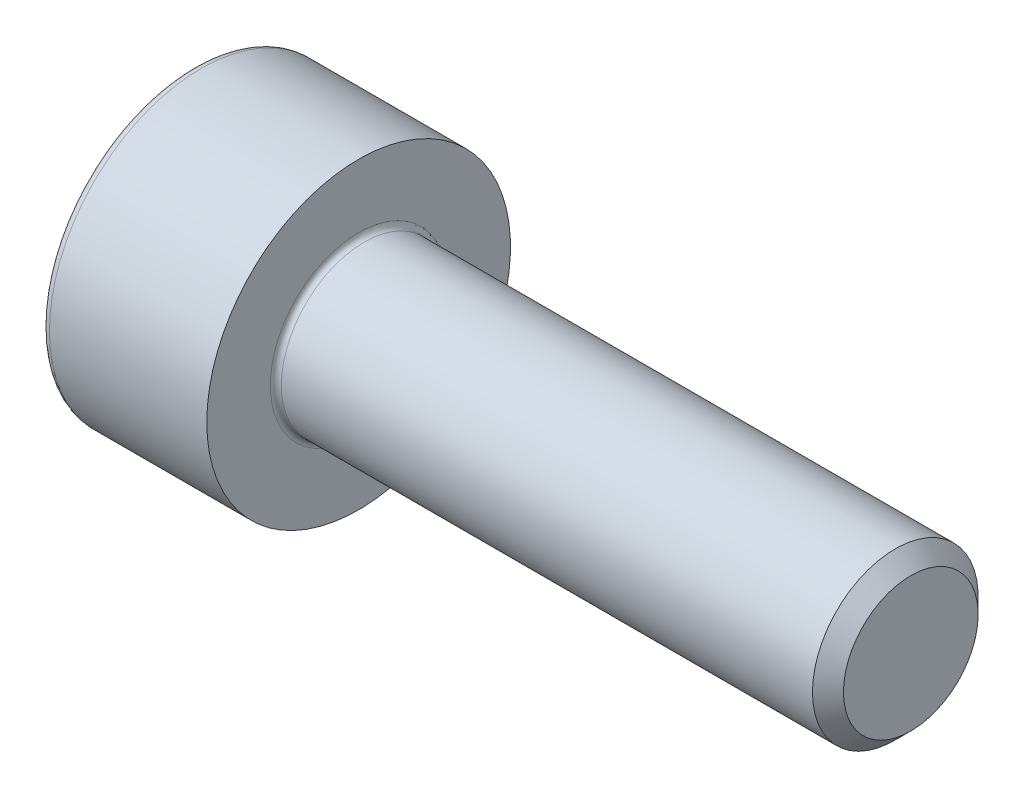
SolidWorks part; units mm, degrees
ref_plane "Plane1" through (0, 0, 0) normal (0, 0, 1) x (1, 0, 0)
ref_plane "Plane2" through (0, 0, 0) normal (0, 1, 0) x (1, 0, 0)
ref_plane "Plane3" through (0, 0, 0) normal (1, 0, 0) x (0, 0, -1)
sketch "BodySke" plane through (0, 0, 0) normal (0, 0, 1) x (1, 0, 0)
  line L0 (0, 0) -> (0, 2.75)
  line L1 (0, 2.75) -> (3, 2.75)
  line L2 (3, 2.75) -> (3, 1.5)
  line L3 (3, 1.5) -> (12.7195, 1.5)
  line L4 (13, 1.2195) -> (13, 0)
  line L5 (13, 0) -> (0, 0)
  line L6 (-31.75, 0) -> (127, 0) construction
  line L8 (13, 1.2195) -> (12.7195, 1.5)
  line L10 (13, -1.2195) -> (12.7195, -1.5) construction
  line L11 (3.5, 9.525) -> (3.5, 3.175) construction
  line L12 (3, 9.525) -> (3, 3.175) construction
  line L13 (-47, 9.525) -> (-47, 3.175) construction
  dimension "Diameter" = 3
  dimension "Head_ht" = 3
  dimension "Length" = 10
  dimension "Body_ch_ang" = 45
  dimension "Head_dia" = 5.5
  dimension "Minor_dia" = 2.439
  dimension "Advance" = 0.5
  dimension "Thread_nom" = 10
  dimension "Thread_length" = 60
revolve "Base-Revolve" add sketch "BodySke"
fillet "Fillet1" radius 0.1 1 edges at (3, 0, 1.5)
fillet "Fillet2" radius 0.15 1 edges at (0, 0, 2.75)
sketch "Sketch2" plane through (0, 0, 0) normal (0, 0, 1) x (1, 0, 0)
  line L0 (0, 1.28) -> (1.3, 1.28)
  line L1 (1.3, 1.28) -> (2.039, 0)
  line L2 (-31.75, 0) -> (127, 0) construction
  line L3 (2.039, 0) -> (0, 0)
  line L4 (0, 0) -> (0, 1.28)
  line L6 (0, 0) -> (47.625, 0) construction
  dimension "D1" = 1.28
  dimension "D2" = 60
  dimension "Depth" = 1.3
revolve "Hex-PreBroach" cut sketch "Sketch2" angle 360 about L6
sketch "Sketch3" plane through (0, 0, 0) normal (-1, 0, 0) x (0, 0.5, 0.866)
  line L0 (0.739, 1.28) -> (-0.739, 1.28)
  line L1 (-0.739, 1.28) -> (-1.478, 0)
  line L2 (0.739, 1.28) -> (1.478, 0)
  line L3 (0.739, -1.28) -> (1.478, 0)
  line L4 (0.739, -1.28) -> (-0.739, -1.28)
  line L5 (-0.739, -1.28) -> (-1.478, 0)
  dimension "D1" = 1.28
  dimension "D2" = 1.28
  dimension "Hex_size" = 2.56
extrude "Hex" cut sketch "Sketch3" against normal blind 1.3
sketch "ThdSchSke" plane through (0, 0, 0) normal (0, 0, 1) x (1, 0, 0)
  line L0 (4.5, -1.2195) -> (4.3036, -1.5)
  line L1 (4.5, -1.2195) -> (4.6964, -1.5)
  line L2 (4.6964, -1.5) -> (4.6964, -1.875)
  line L3 (-3.175, 0) -> (5.1513, 0) construction
  line L4 (0, 2.6) -> (0, -2.6) construction
  line L5 (4.6964, -1.875) -> (4.3036, -1.875)
  line L6 (4.3036, -1.875) -> (4.3036, -1.5)
  dimension "Thread_minor" = 2.439
  dimension "Diameter" = 3
  dimension "Start" = 4.5
  dimension "SideAngle" = 55
  dimension "VeeAngle" = 70
  dimension "Overcut" = 3.75
revolve "ThreadSchematic" [suppressed] cut sketch "ThdSchSke" angle 360 about L3
pattern_linear "ThdSchPat" [suppressed]
equation "\"D2@Sketch3\" = \"Hex_size@Sketch3\" / 2"
equation "\"D1@Sketch3\" = \"Hex_size@Sketch3\" / 2"
equation "\"D1@Sketch2\" = \"Hex_size@Sketch3\" / 2"
equation "\"Thread_minor@ThreadCosmetic\"  =  \"Minor_dia@BodySke\""
equation "\"Depth@Sketch2\" =  \"Key_eng@Hex\""
equation "\"Thread_length@ThreadCosmetic\" = ((sgn( (\"Length@BodySke\" - \"Advance@BodySke\" * 3.0) - \"Thread_nom@BodySke\" )-1)*( (\"Length@BodySke\" - \"Advance@BodySke\" * 3.0) - \"Thread_nom@BodySke\" ))/-2+ \"Thread_no"
equation "\"Thread_minor@ThdSchSke\" = \"Minor_dia@BodySke\""
equation "\"Diameter@ThdSchSke\" = \"Diameter@BodySke\""
equation "\"Overcut@ThdSchSke\" = \"Diameter@BodySke\" * 1.25"
equation "\"Start@ThdSchSke\" = \"Head_ht@BodySke\" + \"Length@BodySke\" - \"Thread_length@ThreadCosmetic\"  '---Non-countersunk---"
equation "\"Num_threads@ThdSchPat\" = int( \"Thread_length@ThreadCosmetic\" / \"Advance@BodySke\" + 0.999 )  + 1"
equation "\"Advance@ThdSchPat\" = \"Thread_length@ThreadCosmetic\" /  (\"Num_threads@ThdSchPat\" - 1) 'relax it"
equation "\"Num_threads@ThdSchPat\" = \"Num_threads@ThdSchPat\" - sgn( \"Num_threads@ThdSchPat\" - 1) '---chamfered tips only---"
